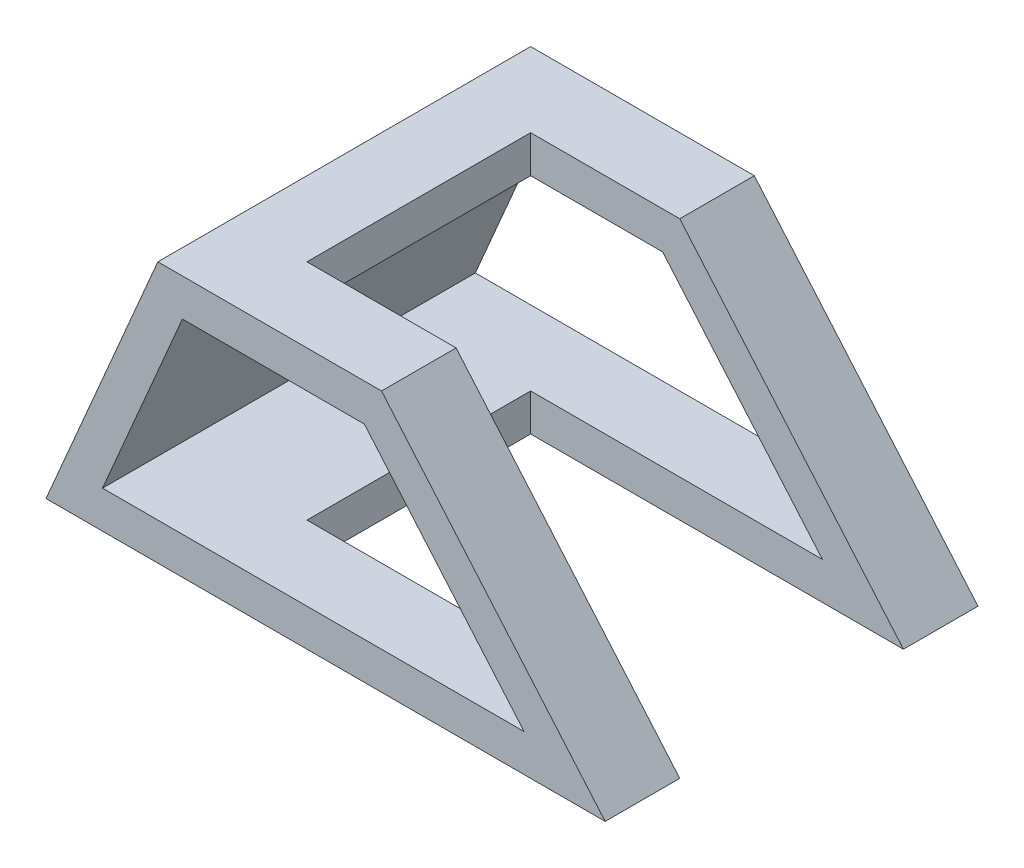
SolidWorks part; units mm, degrees
ref_plane "Front Plane" through (0, 0, 0) normal (0, 0, 1) x (1, 0, 0)
ref_plane "Top Plane" through (0, 0, 0) normal (0, 1, 0) x (1, 0, 0)
ref_plane "Right Plane" through (0, 0, 0) normal (1, 0, 0) x (0, 0, -1)
sketch "Esquisse1" plane through (0, 0, 0) normal (0, 0, 1) x (1, 0, 0)
  line L0 (70.4753, 0) -> (-79.5247, 0)
  line L1 (-79.5247, 0) -> (-49.5247, 70)
  line L2 (-49.5247, 70) -> (10.4753, 70)
  line L3 (10.4753, 70) -> (70.4753, 0)
  line L4 (-64.3593, 10) -> (-42.9307, 60)
  line L5 (-42.9307, 60) -> (5.876, 60)
  line L6 (5.876, 60) -> (48.7331, 10)
  line L7 (48.7331, 10) -> (-64.3593, 10)
  dimension "D1" = 150
  dimension "D2" = 30
  dimension "D3" = 60
  dimension "D4" = 70
  dimension "D5" = 10
extrude "Boss.-Extru.1" add sketch "Esquisse1" along normal mid plane 100
sketch "Esquisse2" plane through (0, 70, 0) normal (0, 1, 0) x (1, 0, 0)
  line L0 (70.4753, -50) -> (70.4753, 50) construction
  line L1 (170.4753, -30) -> (-29.5247, -30)
  line L2 (170.4753, -30) -> (170.4753, 30)
  line L3 (170.4753, 30) -> (-29.5247, 30)
  line L4 (-29.5247, -30) -> (-29.5247, 30)
  line L5 (170.4753, -30) -> (-29.5247, 30) construction
  line L6 (170.4753, 30) -> (-29.5247, -30) construction
  point P0 (70.4753, 0)
  dimension "D1" = 60
  dimension "D2" = 200
extrude "Enlèv. mat.-Extru.1" cut sketch "Esquisse2" against normal through all
